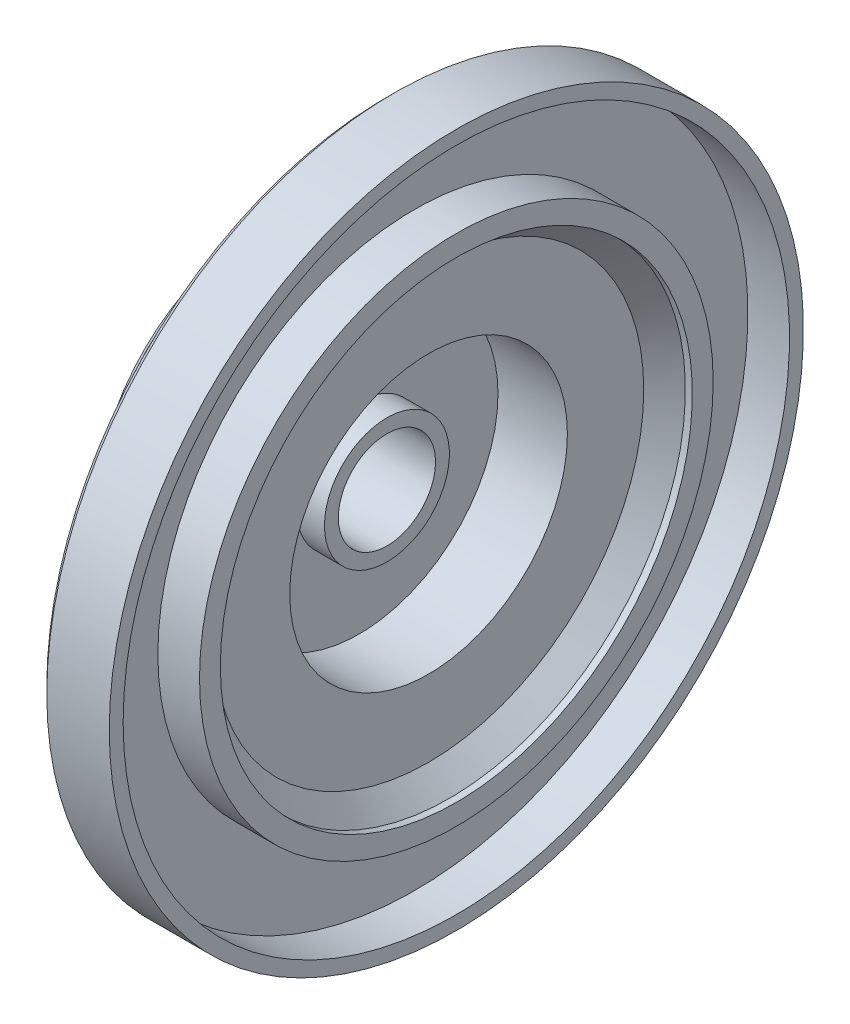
SolidWorks part; units mm, degrees
ref_plane "Plane1" through (0, 0, 0) normal (0, 0, 1) x (1, 0, 0)
ref_plane "Plane2" through (0, 0, 0) normal (0, 1, 0) x (1, 0, 0)
ref_plane "Plane3" through (0, 0, 0) normal (1, 0, 0) x (0, 0, -1)
sketch "Esquisse3" plane through (0, 0, 0) normal (0, 0, 1) x (1, 0, 0)
  line L0 (-17, 3.5) -> (-17, 6)
  line L1 (-17, 6) -> (-16, 7)
  line L2 (-16, 7) -> (-14, 7)
  line L3 (-14, 7) -> (-14, 12)
  line L4 (-14, 12) -> (-13.5, 12.5)
  line L5 (-13.5, 12.5) -> (-4.75, 12.5)
  line L6 (-5, 19.25) -> (-5, 24.5)
  line L7 (-5, 24.5) -> (-4.5, 25)
  line L8 (0, 24) -> (0, 25)
  line L9 (0, 25) -> (-4.5, 25)
  line L10 (-5, 4.5) -> (-7, 4.5)
  line L11 (-7, 4.5) -> (-7, 10)
  line L12 (-7, 10) -> (-2, 10)
  line L13 (0, 0) -> (25, 0) construction
  line L14 (0, 17) -> (-0.5, 17)
  line L15 (-0.5, 17) -> (-2, 15.5)
  line L16 (-2, 15.5) -> (-2, 10)
  line L17 (-5, 19.25) -> (-4.75, 19)
  line L18 (-4.75, 19) -> (-4.75, 12.5)
  line L20 (-5, 4.5) -> (-5, 3.5)
  line L21 (-5, 3.5) -> (-17, 3.5)
  line L22 (0, 24) -> (-3, 24)
  line L23 (-3, 24) -> (-3, 18.5)
  line L24 (-3, 18.5) -> (0, 18.5)
  line L25 (0, 18.5) -> (0, 17)
  dimension "D1" = 1
  dimension "D2" = 3
  dimension "D3" = 0.5
  dimension "D4" = 12
  dimension "D5" = 25
  dimension "D6" = 0.5
  dimension "D7" = 3.5
  dimension "D8" = 4.5
  dimension "D9" = 10
  dimension "D10" = 17
  dimension "D11" = 1.5
  dimension "D12" = 17
  dimension "D13" = 7
  dimension "D14" = 12.5
  dimension "D15" = 135
  dimension "D16" = 18.5
  dimension "D17" = 24
  dimension "D18" = 6
  dimension "D19" = 135
  dimension "D20" = 15
  dimension "D21" = 10
  dimension "D22" = 14
  dimension "D23" = 135
  dimension "D24" = 17
  dimension "D25" = 17
  dimension "D26" = 12
  dimension "D27" = 135
  dimension "D28" = 0.25
  dimension "D29" = 135
revolve "Base-Révolution" add sketch "Esquisse3" angle 360 about L13
sketch "Esquisse10" plane through (-5, 0, 0) normal (-1, 0, 0) x (0, 0, 1)
  line L0 (0, 0) -> (0, 28) construction
  line L1 (-19.6957, -3.4757) -> (-23.6348, -4.1708) construction
  arc A0 (0, 24) -> (-23.6348, -4.1708) centre (0, 0) ccw
  arc A1 (0, 20) -> (0, 24) centre (0, 22) ccw
  arc A2 (0, 20) -> (-19.6957, -3.4757) centre (0, 0) ccw
  arc A3 (-23.6348, -4.1708) -> (-19.6957, -3.4757) centre (-21.6652, -3.8233) ccw
extrude "Enlèv. mat.-Extru.3" cut sketch "Esquisse10" against normal blind 1.5
fillet "Congé1" radius 1
pattern_circular "Répétition circulaire1" count 3 every 120 about axis through (0, 0, 0) along (1, 0, 0)
